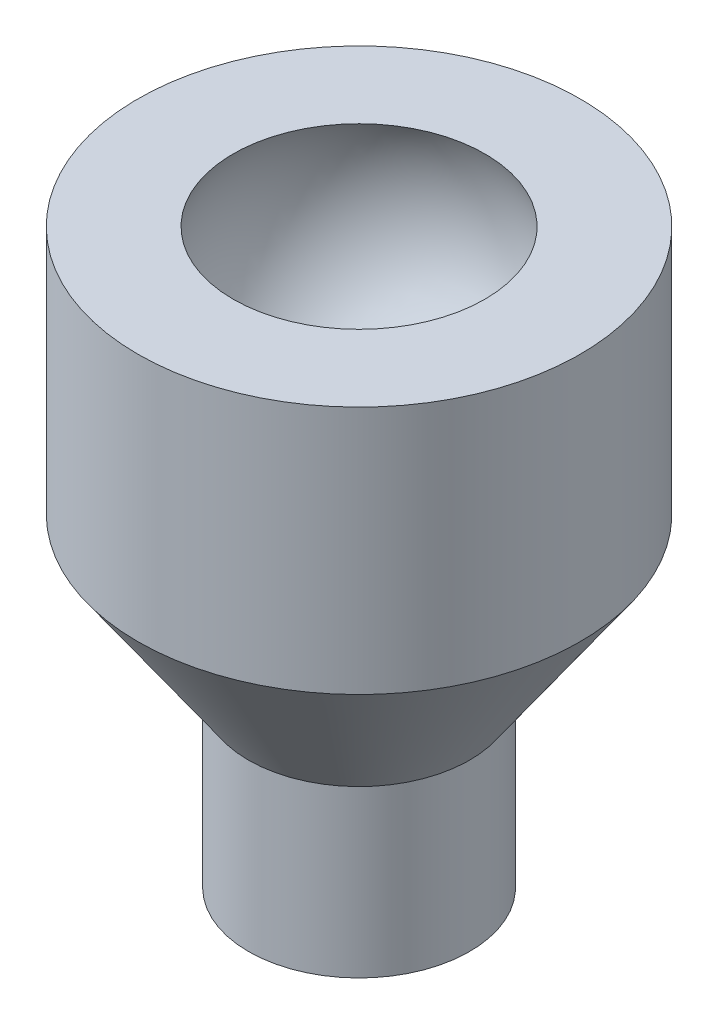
SolidWorks part; units mm, degrees
ref_plane "Front Plane" through (0, 0, 0) normal (0, 0, 1) x (1, 0, 0)
ref_plane "Top Plane" through (0, 0, 0) normal (0, 1, 0) x (1, 0, 0)
ref_plane "Right Plane" through (0, 0, 0) normal (1, 0, 0) x (0, 0, -1)
sketch "Sketch1" plane through (0, 0, 0) normal (0, 1, 0) x (1, 0, 0)
  circle A0 centre (0, 0) radius 2
  circle A1 centre (0, 0) radius 1.13
  dimension "D1" = 4
  dimension "D2" = 2.26
extrude "Boss-Extrude1" add sketch "Sketch1" along normal blind 6
sketch "Sketch2" plane through (0, 0, 0) normal (0, 0, 1) x (1, 0, 0)
  line L0 (-4, 9.1) -> (-2.6, 9.1) construction
  line L3 (0, 9.1) -> (0, 0) construction
  line L4 (0, 5.1) -> (0, 6.5)
  line L5 (2.2771, 10.355) -> (3.798, 10.355)
  line L6 (0.0673, 10.355) -> (2.2771, 10.355) construction
  line L7 (3.798, 10.355) -> (4, 10.355)
  line L8 (4, 10.355) -> (4, 5.8535)
  line L11 (2, 6) -> (-2, 6) construction
  line L12 (4, 5.8535) -> (1.8901, 2.8402)
  line L14 (0, 5.1) -> (1.8901, 5.1)
  line L15 (1.8901, 5.1) -> (1.8901, 2.8402)
  arc A0 (0, 5.1) -> (1.213, 5.2884) centre (0, 9.1) ccw construction
  arc A2 (4, 9.1) -> (0, 5.1) centre (0, 9.1) ccw construction
  arc A3 (2.6, 9.1) -> (-2.6, 9.1) centre (0, 9.1) ccw construction
  arc A4 (-4, 9.1) -> (0, 5.1) centre (0, 9.1) ccw construction
  arc A5 (-2.6, 9.1) -> (0, 6.5) centre (0, 9.1) ccw construction
  arc A6 (3.798, 10.355) -> (-4, 9.1) centre (0, 9.1) ccw construction
  arc A7 (2.2771, 10.355) -> (2.6, 9.1) centre (0, 9.1) ccw construction
  arc A8 (1.213, 5.2884) -> (4, 9.1) centre (0, 9.1) ccw construction
  arc A9 (-2.6, 9.1) -> (0, 6.5) centre (0, 9.1) ccw construction
  arc A10 (0, 6.5) -> (2.2771, 10.355) centre (0, 9.1) ccw
  arc A11 (2.6, 9.1) -> (-2.6, 9.1) centre (0, 9.1) ccw construction
  arc A12 (2.2771, 10.355) -> (2.6, 9.1) centre (0, 9.1) ccw construction
  arc A13 (0, 5.1) -> (1.213, 5.2884) centre (0, 9.1) ccw construction
  arc A14 (1.213, 5.2884) -> (3.798, 10.355) centre (0, 9.1) ccw construction
  dimension "D1" = 8
  dimension "D2" = 2.6
  dimension "D3" = 3.1
  dimension "D4" = 35
  dimension "D5" = 1.4
revolve "Revolve2" add sketch "Sketch2" angle 360 about L3
thread "Thread1" pitch 0.635 start angle 0, offset 0, length 0, pitch 0.635, diameter 2.26
ref_plane "Plane2" through (1.13, 0, 0) normal (0, 0, 1) x (1, 0, 0)
sketch "Thread Profile2" plane through (1.13, 0, 0) normal (0, 0, 1) x (1, 0, 0)
  line L0 (0, 0) -> (0, 0.635) construction
  line L11 (0, 0) -> (0, 0.5556)
  line L12 (0, 0.5556) -> (-0.3437, 0.3572)
  line L13 (-0.3437, 0.3572) -> (-0.3437, 0.1984)
  line L15 (-0.3437, 0.1984) -> (0, 0)
  line L17 (-0.3437, 0.2778) -> (0, 0.2778) construction
  point P2 (0, 0)
  dimension "Pitch" = 0.635
  dimension "Profile_Angle" = 60
  dimension "Profile_Land" = 0.1588
  dimension "Profile_Height" = 0.3437
